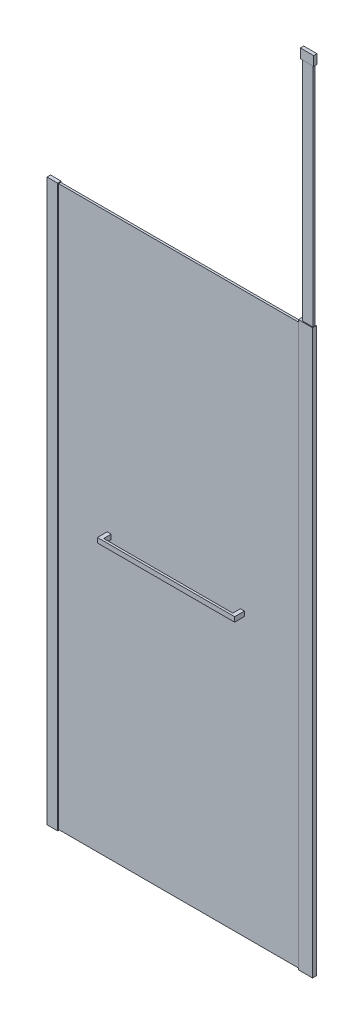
SolidWorks part; units mm, degrees
ref_plane "Płaszczyzna przednia" through (0, 0, 0) normal (0, 0, 1) x (1, 0, 0)
ref_plane "Płaszczyzna górna" through (0, 0, 0) normal (0, 1, 0) x (1, 0, 0)
ref_plane "Płaszczyzna prawa" through (0, 0, 0) normal (1, 0, 0) x (0, 0, -1)
sketch "Szkic1" plane through (0, 0, 0) normal (0, 1, 0) x (1, 0, 0)
  line L0 (0, 0) -> (0, 13.3)
  line L1 (0, 13.3) -> (40, 13.3)
  line L2 (40, 13.3) -> (40, 11.4)
  line L3 (40, 11.4) -> (6.5, 11.4)
  line L4 (6.5, 11.4) -> (6.5, 3.4)
  line L5 (6.5, 3.4) -> (40, 3.4)
  line L6 (40, 3.4) -> (40, 0)
  line L7 (40, 0) -> (0, 0)
  dimension "D1" = 40
  dimension "D2" = 13.3
  dimension "D3" = 33.5
  dimension "D4" = 1.9
  dimension "D5" = 8
extrude "Dodanie-wyciągnięcie1" add sketch "Szkic1" along normal blind 2100 from offset 3
sketch "Szkic2" plane through (0, 3, 0) normal (0, -1, 0) x (1, 0, 0)
  line L0 (6.5, -11.4) -> (40, -11.4) construction
  line L1 (6.5, -3.4) -> (953.5, -3.4)
  line L2 (6.5, -3.4) -> (6.5, -11.4)
  line L3 (6.5, -11.4) -> (953.5, -11.4)
  line L4 (953.5, -3.4) -> (953.5, -11.4)
  dimension "D1" = 947
extrude "Dodanie-wyciągnięcie2" add sketch "Szkic2" against normal blind 2100 separate body
sketch "Szkic3" plane through (0, 3, 0) normal (0, -1, 0) x (1, 0, 0)
  line L0 (943.4, -3.4) -> (943.4, -0.4)
  line L1 (953.5, -3.4) -> (6.5, -3.4) construction
  line L2 (943.4, -0.4) -> (996.4, -0.4)
  line L3 (996.4, -0.4) -> (996.4, -14.4)
  line L4 (996.4, -14.4) -> (943.4, -14.4)
  line L5 (943.4, -14.4) -> (943.4, -11.4)
  line L6 (943.4, -11.4) -> (953.5, -11.4)
  line L7 (953.5, -11.4) -> (953.5, -3.4)
  line L8 (953.5, -3.4) -> (943.4, -3.4)
  line L9 (6.5, -11.4) -> (953.5, -11.4) construction
  line L10 (953.5, -11.4) -> (953.5, -3.4) construction
  dimension "D1" = 10.1
  dimension "D2" = 3
  dimension "D3" = 3
  dimension "D4" = 53
extrude "Dodanie-wyciągnięcie3" add sketch "Szkic3" against normal blind 2108 separate body
sketch "Szkic4" plane through (0, 2103, 0) normal (0, 1, 0) x (1, 0, 0)
  line L1 (0, 13.3) -> (40, 13.3)
  line L2 (0, 13.3) -> (0, 0)
  line L3 (0, 0) -> (40, 0)
  line L4 (40, 13.3) -> (40, 0)
extrude "Dodanie-wyciągnięcie4" add sketch "Szkic4" along normal blind 3
sketch "Szkic5" plane through (0, 2111, 0) normal (0, 1, 0) x (1, 0, 0)
  line L1 (996.4, 14.4) -> (943.4, 14.4)
  line L2 (996.4, 14.4) -> (996.4, 0.4)
  line L3 (996.4, 0.4) -> (943.4, 0.4)
  line L4 (943.4, 14.4) -> (943.4, 0.4)
extrude "Dodanie-wyciągnięcie5" add sketch "Szkic5" along normal blind 3
sketch "Szkic6" plane through (943.4, 0, 0) normal (-1, 0, 0) x (0, 0, 1)
  line L0 (-11.4, 2111) -> (-3.4, 2111) construction
  line L1 (-3.35, 2111) -> (-11.45, 2111)
  line L2 (-3.35, 2111) -> (-3.35, 2103.2)
  line L3 (-3.35, 2103.2) -> (-11.45, 2103.2)
  line L4 (-11.45, 2111) -> (-11.45, 2103.2)
  point P6 (-7.4, 2111)
  dimension "D1" = 8.1
  dimension "D2" = 7.8
extrude "Dodanie-wyciągnięcie6" add sketch "Szkic6" against normal blind 15
sketch "Szkic7" plane through (0, 3, 0) normal (0, -1, 0) x (1, 0, 0)
  line L1 (943.4, -0.4) -> (996.4, -0.4)
  line L2 (943.4, -0.4) -> (943.4, -14.4)
  line L3 (943.4, -14.4) -> (996.4, -14.4)
  line L4 (996.4, -0.4) -> (996.4, -14.4)
extrude "Dodanie-wyciągnięcie7" add sketch "Szkic7" along normal blind 3
sketch "Szkic8" plane through (0, 3, 0) normal (0, -1, 0) x (1, 0, 0)
  line L1 (0, 0) -> (40, 0)
  line L2 (0, 0) -> (0, -13.3)
  line L3 (0, -13.3) -> (40, -13.3)
  line L4 (40, 0) -> (40, -13.3)
extrude "Dodanie-wyciągnięcie8" add sketch "Szkic8" along normal blind 3
sketch "Szkic9" plane through (0, 2114, 2099.6) normal (0, -1, 0) x (-1, 0, 0)
  line L1 (-994.9, 2111) -> (-954.9, 2111)
  line L2 (-994.9, 2111) -> (-994.9, 2103)
  line L3 (-994.9, 2103) -> (-954.9, 2103)
  line L4 (-954.9, 2111) -> (-954.9, 2103)
  line L7 (-943.4, 2114) -> (-996.4, 2114) construction
  line L8 (-996.4, 2114) -> (-996.4, 2100) construction
  dimension "D1" = 3
  dimension "D2" = 1.5
  dimension "D3" = 8
  dimension "D4" = 40
extrude "Dodanie-wyciągnięcie9" add sketch "Szkic9" against normal blind 883 separate body
sketch "Szkic10" plane through (0, 2997, 0) normal (0, 1, 0) x (-1, 0, 0)
  line L0 (-974.9, -11.4) -> (-974.9, -7.4) construction
  line L1 (-999.9, -1.15) -> (-949.9, -1.15)
  line L2 (-999.9, -1.15) -> (-999.9, -13.65)
  line L3 (-999.9, -13.65) -> (-949.9, -13.65)
  line L4 (-949.9, -1.15) -> (-949.9, -13.65)
  line L5 (-999.9, -1.15) -> (-949.9, -13.65) construction
  line L6 (-999.9, -13.65) -> (-949.9, -1.15) construction
  line L7 (-954.9, -11.4) -> (-994.9, -11.4) construction
  line L8 (-974.9, -7.4) -> (-994.9, -7.4) construction
  line L9 (-994.9, -11.4) -> (-994.9, -3.4) construction
  point P0 (-974.9, -7.4)
  dimension "D1" = 12.5
  dimension "D2" = 50
extrude "Dodanie-wyciągnięcie10" add sketch "Szkic10" along normal blind 35 from offset 32
ref_plane "Płaszczyzna1" through (974.9, 0, 0) normal (1, 0, 0) x (0, 0, -1)
sketch "Szkic12" plane through (0, 0, -3.4) normal (0, 0, 1) x (1, 0, 0)
  line L0 (480, 1409.7928) -> (480, 762.3594) construction
  line L1 (230, 1053) -> (730, 1053) construction
  line L2 (6.5, 2103) -> (6.5, 3) construction
  line L3 (953.5, 2103) -> (953.5, 3) construction
  line L5 (222.5, 1062) -> (237.5, 1062)
  line L6 (222.5, 1062) -> (222.5, 1044)
  line L7 (222.5, 1044) -> (237.5, 1044)
  line L8 (237.5, 1062) -> (237.5, 1044)
  line L9 (222.5, 1062) -> (237.5, 1044) construction
  line L10 (222.5, 1044) -> (237.5, 1062) construction
  line L11 (722.5, 1062) -> (737.5, 1062)
  line L12 (722.5, 1062) -> (722.5, 1044)
  line L13 (722.5, 1044) -> (737.5, 1044)
  line L14 (737.5, 1062) -> (737.5, 1044)
  line L15 (722.5, 1062) -> (737.5, 1044) construction
  line L16 (722.5, 1044) -> (737.5, 1062) construction
  dimension "D1" = 1053
  dimension "D2" = 500
  dimension "D3" = 15
  dimension "D4" = 18
extrude "Dodanie-wyciągnięcie11" add sketch "Szkic12" along normal blind 36.5 and the other way blind 18 separate body
sketch "Szkic13" plane through (237.5, 0, 0) normal (1, 0, 0) x (0, 0, -1)
  line L0 (21.4, 1044) -> (-33.1, 1044) construction
  line L1 (-33.1, 1062) -> (-25.1, 1062)
  line L2 (-33.1, 1062) -> (-33.1, 1044)
  line L3 (-33.1, 1044) -> (-25.1, 1044)
  line L4 (-25.1, 1062) -> (-25.1, 1044)
  dimension "D1" = 8
extrude "Dodanie-wyciągnięcie12" add sketch "Szkic13" along normal up to surface (485 mm away)
